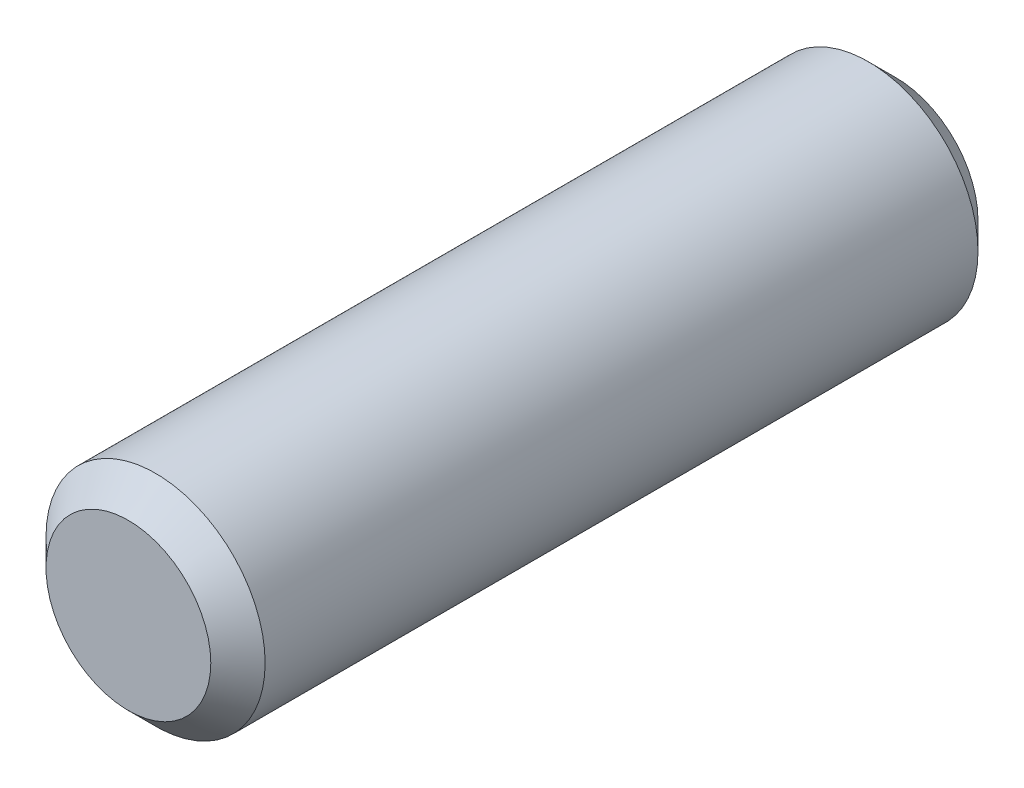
SolidWorks part; units mm, degrees
ref_plane "Front Plane" through (0, 0, 0) normal (0, 0, 1) x (1, 0, 0)
ref_plane "Top Plane" through (0, 0, 0) normal (0, 1, 0) x (1, 0, 0)
ref_plane "Right Plane" through (0, 0, 0) normal (1, 0, 0) x (0, 0, -1)
ref_plane "Plane4" through (0, 0, 0) normal (0, 0, 1) x (-1, 0, 0)
sketch "PIN2" plane through (0, 0, 0) normal (0, 0, 1) x (-1, 0, 0)
  circle A0 centre (0, 0) radius 4.2333
  dimension "D1" = 8.4667
extrude "Extrude1" add sketch "PIN2" along normal blind 29.6418
chamfer "Chamfer1" distance 1.0499 angle 45 2 edges at (4.2333, 0, 0) (4.2333, 0, 29.6418)
